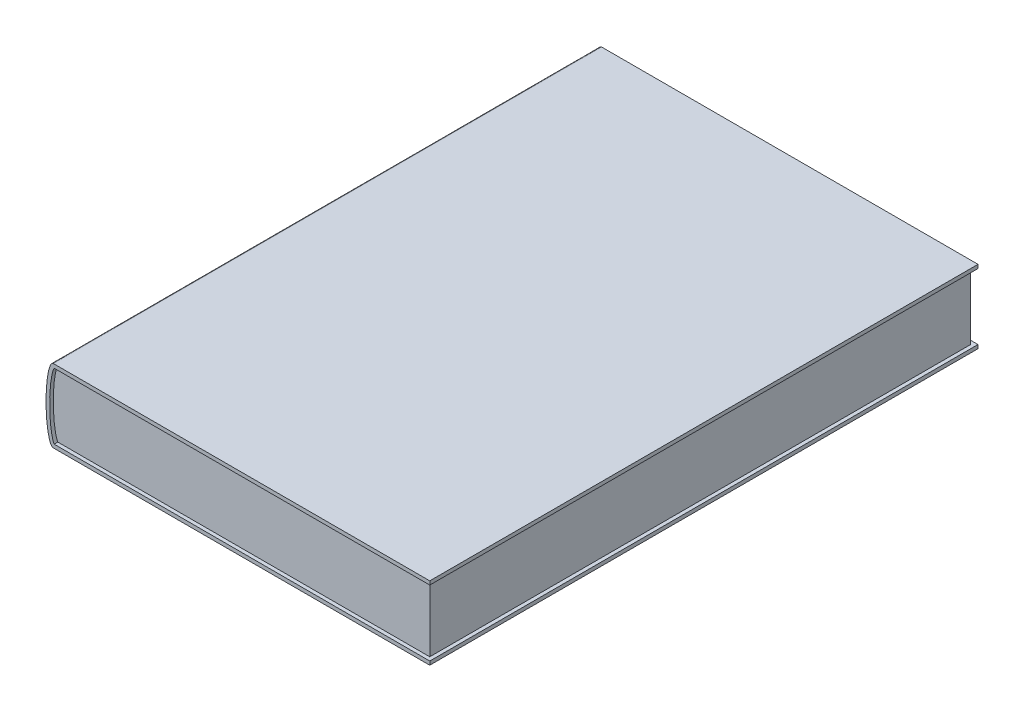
SolidWorks part; units mm, degrees
ref_plane "Plan de face" through (0, 0, 0) normal (0, 0, 1) x (1, 0, 0)
ref_plane "Plan de dessus" through (0, 0, 0) normal (0, 1, 0) x (1, 0, 0)
ref_plane "Plan de droite" through (0, 0, 0) normal (1, 0, 0) x (0, 0, -1)
sketch "Esquisse1" plane through (0, 0, 0) normal (0, 0, 1) x (1, 0, 0)
  line L1 (103, 20) -> (-103, 20)
  line L2 (-107, 19.9518) -> (-107, -19.9518) construction
  line L3 (-103, -20) -> (103, -20)
  line L4 (0, 20) -> (0, -20) construction
  line L5 (0, -22) -> (0, 22) construction
  line L6 (115.5, 0) -> (-115.5, 0) construction
  line L11 (103, 18) -> (-102.5159, 18)
  line L12 (-102.5159, -18) -> (103, -18)
  line L13 (103, 20) -> (103, 18)
  line L14 (103, -18) -> (103, -20)
  ellipse E0 centre (-103, 0) end of major axis (-103, 20) minor radius 4 (-103, 20) -> (-103, -20) ccw
  spline S0 degree 1 poles (-102.5159, 18) (-102.5159, -18) knots 0 0 1 1 construction
  spline S1 degree 3 poles (-102.5159, 18) (-102.5479, 17.9493) (-102.6037, 17.8549) (-102.744, 17.5881) (-102.9321, 17.1643) (-103.1698, 16.5114) (-103.4856, 15.4716) (-103.8637, 13.8799) (-104.2602, 11.5815) (-104.5833, 8.9678) (-104.901, 5.1628) (-105.066, 0) (-104.901, -5.1628) (-104.5833, -8.9678) (-104.2602, -11.5815) (-103.8637, -13.8799) (-103.4856, -15.4716) (-103.1698, -16.5114) (-102.9321, -17.1643) (-102.744, -17.5881) (-102.6037, -17.8549) (-102.5479, -17.9493) (-102.5159, -18) knots 0.306339 0.306339 0.306339 0.306339 0.345853 0.385367 0.464396 0.543424 0.622453 0.78051 0.938567 1.096625 1.254682 1.570796 1.886911 2.044968 2.203025 2.361082 2.51914 2.598168 2.677197 2.756225 2.79574 2.835254 2.835254 2.835254 2.835254
  point P16 (-107, 0)
  dimension "D1" = 103
  dimension "D2" = 40
  dimension "D3" = 4
  dimension "D4" = 2
extrude "Boss.-Extru.1" add sketch "Esquisse1" along normal mid plane 300
sketch "Esquisse2" plane through (0, 0, 0) normal (0, 0, 1) x (1, 0, 0)
  line L0 (-102.5159, -18) -> (103, -18) construction
  line L1 (103, 18) -> (-102.5159, 18) construction
  line L2 (-102.5159, -18) -> (101, -18)
  line L3 (101, 18) -> (-102.5159, 18)
  line L4 (103, -18) -> (103, -20) construction
  line L5 (101, 18) -> (101, -18)
  spline S0 degree 3 poles (921.3491, 1735.9568) (-108.8327, -1.9887) (-100.8362, 21.2157) (-102.744, 17.5881) (-102.9321, 17.1643) (-103.1698, 16.5114) (-103.4856, 15.4716) (-103.8637, 13.8799) (-104.2602, 11.5815) (-104.5833, 8.9678) (-104.901, 5.1628) (-105.066, 0) (-104.901, -5.1628) (-104.5833, -8.9678) (-104.2602, -11.5815) (-103.8637, -13.8799) (-103.4856, -15.4716) (-103.1698, -16.5114) (-102.9321, -17.1643) (-102.744, -17.5881) (-100.8362, -21.2157) (-108.8328, 1.9889) (921.363, -1735.9802) knots -1.685234 -1.685234 -1.685234 -1.685234 0.345853 0.385367 0.464396 0.543424 0.622453 0.78051 0.938567 1.096625 1.254682 1.570796 1.886911 2.044968 2.203025 2.361082 2.51914 2.598168 2.677197 2.756225 2.79574 4.826836 4.826836 4.826836 4.826836 only from (-102.5159, 18) to (-102.5159, -18) construction
  spline S1 degree 3 poles (-102.5159, 18) (-102.5479, 17.9493) (-102.6037, 17.8549) (-102.744, 17.5881) (-102.9321, 17.1643) (-103.1698, 16.5114) (-103.4856, 15.4716) (-103.8637, 13.8799) (-104.2602, 11.5815) (-104.5833, 8.9678) (-104.901, 5.1628) (-105.066, 0) (-104.901, -5.1628) (-104.5833, -8.9678) (-104.2602, -11.5815) (-103.8637, -13.8799) (-103.4856, -15.4716) (-103.1698, -16.5114) (-102.9321, -17.1643) (-102.744, -17.5881) (-102.6037, -17.8549) (-102.5479, -17.9493) (-102.5159, -18) knots 0.306339 0.306339 0.306339 0.306339 0.345853 0.385367 0.464396 0.543424 0.622453 0.78051 0.938567 1.096625 1.254682 1.570796 1.886911 2.044968 2.203025 2.361082 2.51914 2.598168 2.677197 2.756225 2.79574 2.835254 2.835254 2.835254 2.835254
  dimension "D1" = 2
extrude "Boss.-Extru.2" add sketch "Esquisse2" along normal mid plane 296 contours L5 L2 S1 L3
